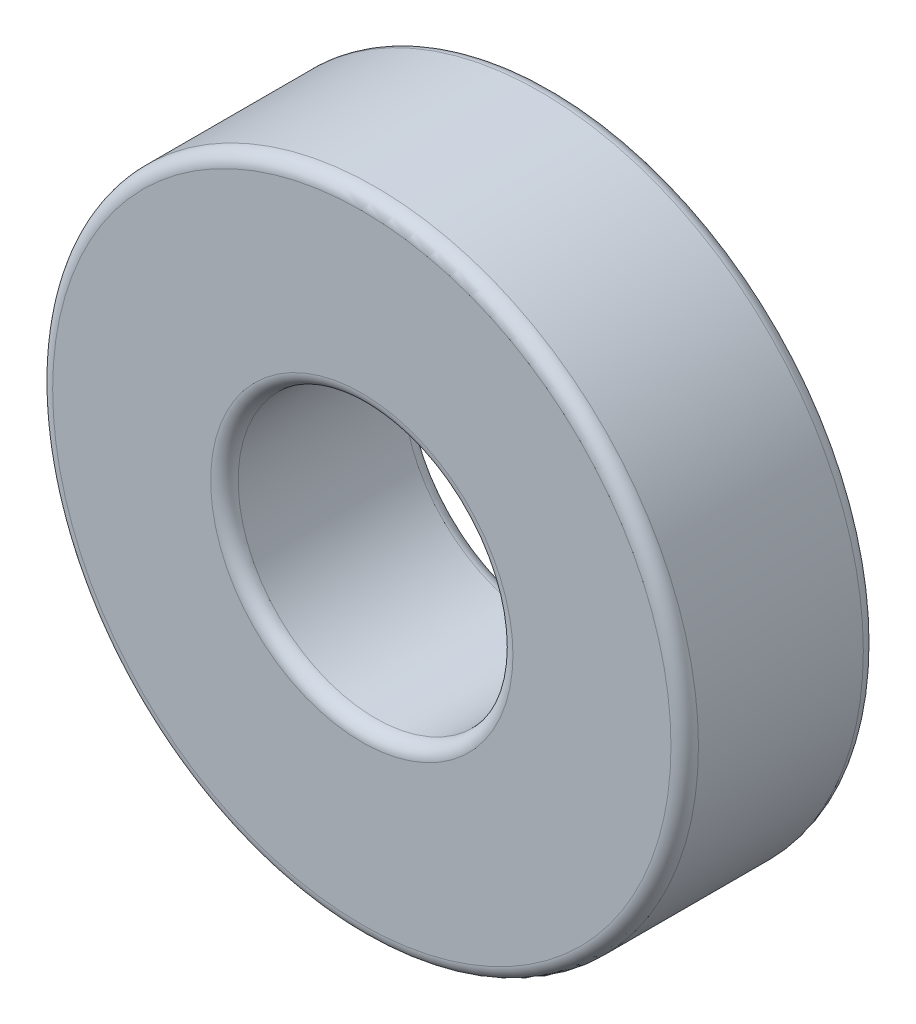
SolidWorks part; units mm, degrees
ref_plane "Plan de face" through (0, 0, 0) normal (0, 0, 1) x (1, 0, 0)
ref_plane "Plan de dessus" through (0, 0, 0) normal (0, 1, 0) x (1, 0, 0)
ref_plane "Plan de droite" through (0, 0, 0) normal (1, 0, 0) x (0, 0, -1)
sketch "Esquisse1" plane through (0, 0, 0) normal (0, 0, 1) x (1, 0, 0)
  circle A0 centre (0, 0) radius 23.5
  circle A1 centre (0, 0) radius 10
  dimension "D1" = 20
  dimension "D2" = 47
extrude "Extrusion1" add sketch "Esquisse1" along normal blind 14
fillet "Congé1" radius 1 4 edges at (23.5, 0, 0) (10, 0, 0) (10, 0, 14) (23.5, 0, 14)
